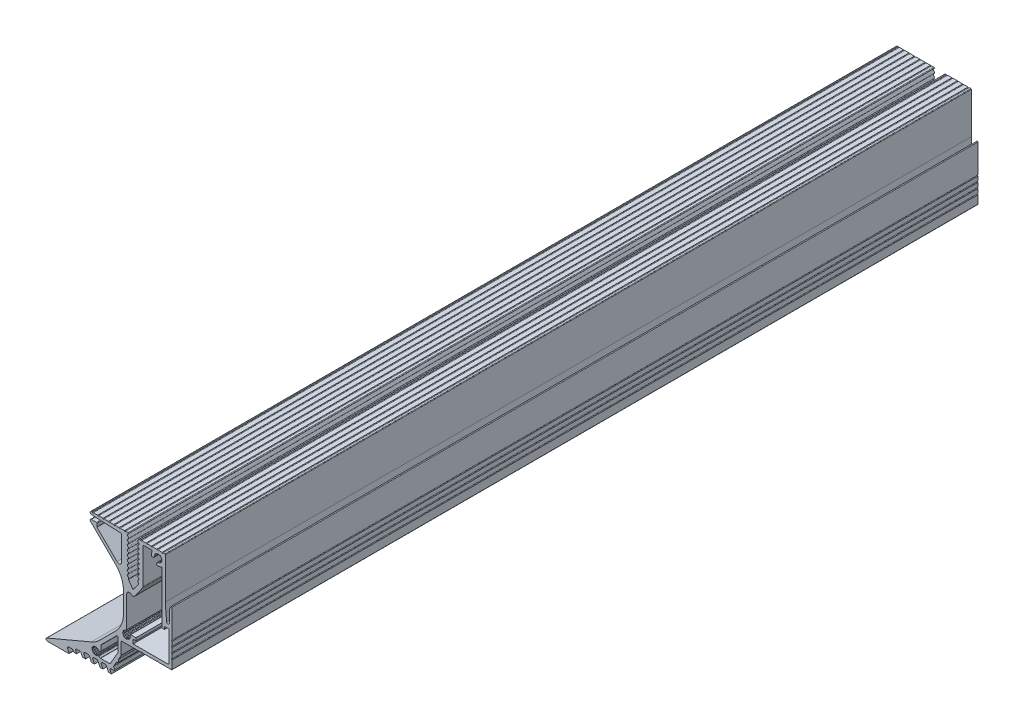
SolidWorks part; units mm, degrees
ref_plane "Спереди" through (0, 0, 0) normal (0, 0, 1) x (1, 0, 0)
ref_plane "Сверху" through (0, 0, 0) normal (0, 1, 0) x (1, 0, 0)
ref_plane "Справа" through (0, 0, 0) normal (1, 0, 0) x (0, 0, -1)
sketch "Model" plane through (0, 0, 0) normal (0, 0, 1) x (1, 0, 0)
  line L0 (487.9568, 2179.62) -> (493.7584, 2185.4217)
  line L1 (494.2706, 2185.2095) -> (494.2706, 2180.4042)
  line L2 (494.2036, 2180.1542) -> (491.4535, 2175.3909)
  line L3 (491.0205, 2175.1409) -> (487.7845, 2175.1409)
  line L4 (487.656, 2175.1877) -> (487.2191, 2175.5542)
  line L5 (487.4874, 2177.195) -> (487.742, 2177.2951)
  line L6 (487.8689, 2177.4813) -> (487.8689, 2179.4079)
  line L7 (503.8017, 2219.5596) -> (506.8266, 2219.5596)
  line L8 (507.0211, 2217.4924) -> (507.6614, 2217.6746)
  line L9 (508.8286, 2216.5431) -> (508.6662, 2215.8975)
  line L10 (510.6649, 2215.7229) -> (510.6649, 2196.5419)
  line L11 (510.8649, 2196.3419) -> (511.4649, 2196.3419)
  line L12 (511.6649, 2196.5419) -> (511.6649, 2197.3419)
  line L13 (511.6649, 2197.3419) -> (513.1649, 2197.3419)
  line L14 (513.1649, 2197.3419) -> (513.1649, 2186.0405)
  line L15 (512.9649, 2185.8405) -> (499.911, 2185.8405)
  line L16 (499.911, 2185.8405) -> (499.911, 2187.3405)
  line L17 (499.911, 2187.3405) -> (500.911, 2187.3405)
  line L18 (500.911, 2187.3405) -> (500.911, 2188.3405)
  line L19 (500.911, 2188.3405) -> (498.9519, 2188.3405)
  line L20 (497.4978, 2189.2112) -> (497.5049, 2200.7622)
  line L21 (500.644, 2201.6975) -> (503.4236, 2205.7071)
  line L22 (503.6017, 2206.2768) -> (503.6017, 2219.3596)
  line L23 (497.1063, 2220.7596) -> (497.9094, 2220.7596)
  line L24 (498.1801, 2205.7431) -> (499.7374, 2203.4967)
  line L25 (500.0661, 2203.4967) -> (501.961, 2206.2302)
  line L26 (502.2749, 2220.7596) -> (502.6808, 2220.7596)
  line L27 (503.0808, 2220.7596) -> (504.6808, 2220.7596)
  line L28 (505.0808, 2220.7596) -> (506.6808, 2220.7596)
  line L29 (507.0808, 2220.7596) -> (508.6808, 2220.7596)
  line L30 (509.0808, 2220.7596) -> (510.6849, 2220.7596)
  line L31 (511.0849, 2220.7596) -> (511.6649, 2220.7596)
  line L32 (511.8649, 2220.5596) -> (511.8649, 2205.3267)
  line L33 (511.8649, 2205.3267) -> (511.8656, 2205.3107)
  line L34 (511.8656, 2205.3107) -> (512.3527, 2199.2203)
  line L35 (513.3649, 2199.2608) -> (513.3649, 2203.5476)
  line L36 (513.3825, 2203.6296) -> (513.9825, 2204.9639)
  line L37 (514.3649, 2204.8818) -> (514.3649, 2194.2918)
  line L38 (514.3649, 2193.8918) -> (514.3649, 2192.2918)
  line L39 (514.3649, 2191.8918) -> (514.3649, 2190.2918)
  line L40 (514.3649, 2189.8918) -> (514.3649, 2188.2918)
  line L41 (514.3649, 2187.8918) -> (514.3649, 2184.8405)
  line L42 (514.1649, 2184.6405) -> (511.2386, 2184.6405)
  line L43 (510.8386, 2184.6405) -> (509.2386, 2184.6405)
  line L44 (508.8386, 2184.6405) -> (507.2386, 2184.6405)
  line L45 (506.8386, 2184.6405) -> (505.2386, 2184.6405)
  line L46 (504.8386, 2184.6405) -> (503.2386, 2184.6405)
  line L47 (502.8386, 2184.6405) -> (495.6706, 2184.6405)
  line L48 (495.4706, 2184.4405) -> (495.4706, 2180.0022)
  line L49 (495.4438, 2179.9022) -> (494.4435, 2178.1697)
  line L50 (493.5964, 2176.7025) -> (492.7401, 2175.2193)
  line L51 (492.72, 2174.758) -> (492.9505, 2174.2635)
  line L52 (491.3832, 2173.0905) -> (491.8262, 2172.1405)
  line L53 (491.8262, 2172.1405) -> (490.7229, 2172.1405)
  line L54 (490.7229, 2172.1405) -> (489.9247, 2173.8522)
  line L55 (489.4716, 2174.1409) -> (488.5093, 2174.1409)
  line L56 (488.0562, 2173.4296) -> (488.6572, 2172.1405)
  line L57 (488.6572, 2172.1405) -> (487.5539, 2172.1405)
  line L58 (487.5539, 2172.1405) -> (486.7557, 2173.8522)
  line L59 (486.3026, 2174.1409) -> (485.3403, 2174.1409)
  line L60 (484.8872, 2173.4296) -> (485.4882, 2172.1405)
  line L61 (485.4882, 2172.1405) -> (484.3849, 2172.1405)
  line L62 (484.3849, 2172.1405) -> (483.5867, 2173.8522)
  line L63 (483.1336, 2174.1409) -> (482.0302, 2174.1409)
  line L64 (481.577, 2173.4296) -> (482.1781, 2172.1405)
  line L65 (482.1781, 2172.1405) -> (481.0747, 2172.1405)
  line L66 (481.0747, 2172.1405) -> (480.5045, 2173.3634)
  line L67 (480.0514, 2173.652) -> (478.948, 2173.652)
  line L68 (478.4948, 2172.9407) -> (478.868, 2172.1405)
  line L69 (478.868, 2172.1405) -> (477.7646, 2172.1405)
  line L70 (477.7646, 2172.1405) -> (477.5468, 2172.6076)
  line L71 (477.0936, 2172.8963) -> (475.9903, 2172.8963)
  line L72 (475.5371, 2172.185) -> (476.0712, 2171.0397)
  line L73 (475.8899, 2170.7551) -> (467.9611, 2170.7551)
  line L74 (467.7697, 2171.6973) -> (484.3175, 2178.7105)
  line L75 (487.4864, 2180.8467) -> (493.376, 2186.7363)
  line L76 (496.3049, 2193.8074) -> (496.3049, 2201.1501)
  line L77 (493.3219, 2208.2748) -> (484.0554, 2217.4012)
  line L78 (484.4272, 2218.257) -> (486.2147, 2218.1819)
  line L79 (486.4063, 2217.9821) -> (486.4063, 2216.8539)
  line L80 (486.4659, 2216.7114) -> (493.9032, 2209.3866)
  line L81 (495.6049, 2210.099) -> (495.6049, 2219.0972)
  line L82 (495.4133, 2219.297) -> (484.3853, 2219.7601)
  line L83 (484.4063, 2220.7596) -> (484.7063, 2220.7596)
  line L84 (485.1063, 2220.7596) -> (486.7063, 2220.7596)
  line L85 (487.1063, 2220.7596) -> (488.7063, 2220.7596)
  line L86 (489.1063, 2220.7596) -> (490.7063, 2220.7596)
  line L87 (491.1063, 2220.7596) -> (492.7063, 2220.7596)
  line L88 (493.1063, 2220.7596) -> (494.7063, 2220.7596)
  line L89 (495.1063, 2220.7596) -> (496.7063, 2220.7596)
  arc A0 (496.1782, 2188.3188) -> (496.2333, 2188.3905) centre (488.2759, 2194.4469) ccw
  arc A1 (487.9568, 2179.62) -> (487.8689, 2179.4079) centre (488.1689, 2179.4079) ccw
  arc A2 (494.2706, 2185.2095) -> (493.7584, 2185.4217) centre (493.9706, 2185.2095) ccw
  arc A3 (494.2036, 2180.1542) -> (494.2706, 2180.4042) centre (493.7706, 2180.4042) ccw
  arc A4 (491.0205, 2175.1409) -> (491.4535, 2175.3909) centre (491.0205, 2175.6409) ccw
  arc A5 (487.656, 2175.1877) -> (487.7845, 2175.1409) centre (487.7845, 2175.3409) ccw
  arc A6 (487.2191, 2175.5542) -> (486.9455, 2175.5387) centre (487.0905, 2175.401) ccw
  arc A7 (486.7653, 2175.51) -> (486.9455, 2175.5387) centre (486.8366, 2175.6421) ccw
  arc A8 (486.7653, 2175.51) -> (486.4853, 2175.3536) centre (486.675, 2175.3428) ccw
  arc A9 (486.2139, 2175.2741) -> (486.4853, 2175.3536) centre (486.3354, 2175.3621) ccw
  arc A10 (486.2139, 2175.2741) -> (485.8937, 2175.2547) centre (486.06, 2175.1626) ccw
  arc A11 (485.6147, 2175.3008) -> (485.8937, 2175.2547) centre (485.7624, 2175.3274) ccw
  arc A12 (485.6147, 2175.3008) -> (485.3179, 2175.4222) centre (485.4277, 2175.2672) ccw
  arc A13 (485.0864, 2175.5849) -> (485.3179, 2175.4222) centre (485.231, 2175.5446) ccw
  arc A14 (485.0864, 2175.5849) -> (484.8717, 2175.823) centre (484.9034, 2175.6357) ccw
  arc A15 (484.7338, 2176.07) -> (484.8717, 2175.823) centre (484.8466, 2175.971) ccw
  arc A16 (484.7338, 2176.07) -> (484.6436, 2176.3777) centre (484.5909, 2176.1952) ccw
  arc A17 (484.6265, 2176.66) -> (484.6436, 2176.3777) centre (484.6853, 2176.5219) ccw
  arc A18 (484.6265, 2176.66) -> (484.6788, 2176.9764) centre (484.5521, 2176.8349) ccw
  arc A19 (484.7858, 2177.2382) -> (484.6788, 2176.9764) centre (484.7789, 2177.0883) ccw
  arc A20 (484.7858, 2177.2382) -> (484.9703, 2177.5006) centre (484.7947, 2177.428) ccw
  arc A21 (485.1803, 2177.69) -> (484.9703, 2177.5006) centre (485.109, 2177.558) ccw
  arc A22 (485.1803, 2177.69) -> (485.4603, 2177.8464) centre (485.2706, 2177.8572) ccw
  arc A23 (485.7323, 2177.9251) -> (485.4603, 2177.8464) centre (485.6101, 2177.8379) ccw
  arc A24 (485.7323, 2177.9251) -> (486.0518, 2177.9453) centre (485.8856, 2178.0374) ccw
  arc A25 (486.3309, 2177.8992) -> (486.0518, 2177.9453) centre (486.1832, 2177.8726) ccw
  arc A26 (486.3309, 2177.8992) -> (486.6277, 2177.7778) centre (486.5179, 2177.9329) ccw
  arc A27 (486.8591, 2177.6152) -> (486.6277, 2177.7778) centre (486.7145, 2177.6553) ccw
  arc A28 (486.8591, 2177.6152) -> (487.0739, 2177.377) centre (487.0422, 2177.5644) ccw
  arc A29 (487.2341, 2177.2943) -> (487.0739, 2177.377) centre (487.0989, 2177.229) ccw
  arc A30 (487.2341, 2177.2943) -> (487.4874, 2177.195) centre (487.4142, 2177.3812) ccw
  arc A31 (487.742, 2177.2951) -> (487.8689, 2177.4813) centre (487.6689, 2177.4813) ccw
  arc A32 (507.0042, 2219.2678) -> (506.8266, 2219.5596) centre (506.8266, 2219.3596) ccw
  arc A33 (507.0042, 2219.2678) -> (506.77, 2217.647) centre (509.225, 2218.1196) ccw
  arc A34 (506.77, 2217.647) -> (507.0211, 2217.4924) centre (506.9664, 2217.6848) ccw
  arc A35 (507.6614, 2217.6746) -> (507.8003, 2217.9174) centre (507.6069, 2217.8669) ccw
  arc A36 (507.8777, 2218.089) -> (507.8003, 2217.9174) centre (507.9455, 2217.9551) ccw
  arc A37 (507.8777, 2218.089) -> (507.9086, 2218.4082) centre (507.7917, 2218.2584) ccw
  arc A38 (507.9978, 2218.6766) -> (507.9086, 2218.4082) centre (508.001, 2218.5265) ccw
  arc A39 (507.9978, 2218.6766) -> (508.1642, 2218.9508) centre (507.9939, 2218.8666) ccw
  arc A40 (508.3611, 2219.1539) -> (508.1642, 2218.9508) centre (508.2988, 2219.0173) ccw
  arc A41 (508.3611, 2219.1539) -> (508.6299, 2219.3287) centre (508.4399, 2219.3267) ccw
  arc A42 (508.8954, 2219.4263) -> (508.6299, 2219.3287) centre (508.78, 2219.3303) ccw
  arc A43 (508.8954, 2219.4263) -> (509.2135, 2219.4671) centre (509.0414, 2219.5478) ccw
  arc A44 (509.495, 2219.4399) -> (509.2135, 2219.4671) centre (509.3494, 2219.4034) ccw
  arc A45 (509.495, 2219.4399) -> (509.7993, 2219.3387) centre (509.6793, 2219.486) ccw
  arc A46 (510.0411, 2219.1919) -> (509.7993, 2219.3387) centre (509.8941, 2219.2223) ccw
  arc A47 (510.0411, 2219.1919) -> (510.2714, 2218.9687) centre (510.2272, 2219.1535) ccw
  arc A48 (510.4256, 2218.7316) -> (510.2714, 2218.9687) centre (510.3063, 2218.8227) ccw
  arc A49 (510.4256, 2218.7316) -> (510.5362, 2218.4306) centre (510.5766, 2218.6163) ccw
  arc A50 (510.5723, 2218.1501) -> (510.5362, 2218.4306) centre (510.5043, 2218.2839) ccw
  arc A51 (510.5723, 2218.1501) -> (510.5413, 2217.8309) centre (510.6582, 2217.9806) ccw
  arc A52 (510.4521, 2217.5625) -> (510.5413, 2217.8309) centre (510.449, 2217.7125) ccw
  arc A53 (510.4521, 2217.5625) -> (510.2857, 2217.2883) centre (510.456, 2217.3725) ccw
  arc A54 (510.0889, 2217.0852) -> (510.2857, 2217.2883) centre (510.1512, 2217.2218) ccw
  arc A55 (510.0889, 2217.0852) -> (509.82, 2216.9104) centre (510.01, 2216.9123) ccw
  arc A56 (509.5545, 2216.8128) -> (509.82, 2216.9104) centre (509.6699, 2216.9087) ccw
  arc A57 (509.5545, 2216.8128) -> (509.2364, 2216.7719) centre (509.4085, 2216.6913) ccw
  arc A58 (509.0671, 2216.6893) -> (509.2364, 2216.7719) centre (509.1005, 2216.8356) ccw
  arc A59 (509.0671, 2216.6893) -> (508.8286, 2216.5431) centre (509.0225, 2216.4944) ccw
  arc A60 (508.6662, 2215.8975) -> (508.8284, 2215.6512) centre (508.8591, 2215.848) ccw
  arc A61 (508.8284, 2215.6512) -> (510.3726, 2215.9003) centre (509.2249, 2218.1045) ccw
  arc A62 (510.6649, 2215.7229) -> (510.3726, 2215.9003) centre (510.4649, 2215.7229) ccw
  arc A63 (510.6649, 2196.5419) -> (510.8649, 2196.3419) centre (510.8649, 2196.5419) ccw
  arc A64 (511.4649, 2196.3419) -> (511.6649, 2196.5419) centre (511.4649, 2196.5419) ccw
  arc A65 (512.9649, 2185.8405) -> (513.1649, 2186.0405) centre (512.9649, 2186.0405) ccw
  arc A66 (498.9519, 2188.3405) -> (498.7673, 2188.0635) centre (498.9519, 2188.1405) ccw
  arc A67 (498.7229, 2187.8889) -> (498.7673, 2188.0635) centre (498.6288, 2188.0058) ccw
  arc A68 (498.7229, 2187.8889) -> (498.7586, 2187.5702) centre (498.8421, 2187.7409) ccw
  arc A69 (498.7268, 2187.2891) -> (498.7586, 2187.5702) centre (498.6928, 2187.4353) ccw
  arc A70 (498.7268, 2187.2891) -> (498.6207, 2186.9865) centre (498.7699, 2187.1041) ccw
  arc A71 (498.4701, 2186.7471) -> (498.6207, 2186.9865) centre (498.5028, 2186.8936) ccw
  arc A72 (498.4701, 2186.7471) -> (498.2432, 2186.5205) centre (498.4286, 2186.5617) ccw
  arc A73 (498.0036, 2186.3701) -> (498.2432, 2186.5205) centre (498.0966, 2186.4879) ccw
  arc A74 (498.0036, 2186.3701) -> (497.7008, 2186.2644) centre (497.8858, 2186.221) ccw
  arc A75 (497.4197, 2186.2329) -> (497.7008, 2186.2644) centre (497.5547, 2186.2986) ccw
  arc A76 (497.4197, 2186.2329) -> (497.1011, 2186.269) centre (497.2489, 2186.1497) ccw
  arc A77 (496.8342, 2186.3626) -> (497.1011, 2186.269) centre (496.9843, 2186.3632) ccw
  arc A78 (496.8342, 2186.3626) -> (496.5627, 2186.5333) centre (496.6442, 2186.3617) ccw
  arc A79 (496.3628, 2186.7335) -> (496.5627, 2186.5333) centre (496.4984, 2186.669) ccw
  arc A80 (496.3628, 2186.7335) -> (496.1924, 2187.0051) centre (496.1913, 2186.8151) ccw
  arc A81 (496.0991, 2187.2721) -> (496.1924, 2187.0051) centre (496.1933, 2187.1552) ccw
  arc A82 (496.0991, 2187.2721) -> (496.0634, 2187.5908) centre (495.98, 2187.4201) ccw
  arc A83 (496.0952, 2187.8719) -> (496.0634, 2187.5908) centre (496.1293, 2187.7257) ccw
  arc A84 (496.0952, 2187.8719) -> (496.2013, 2188.1745) centre (496.0521, 2188.0569) ccw
  arc A85 (496.352, 2188.4139) -> (496.2013, 2188.1745) centre (496.3192, 2188.2674) ccw
  arc A86 (496.352, 2188.4139) -> (496.5789, 2188.6405) centre (496.3934, 2188.5993) ccw
  arc A87 (496.8185, 2188.7909) -> (496.5789, 2188.6405) centre (496.7254, 2188.6731) ccw
  arc A88 (496.8185, 2188.7909) -> (497.1212, 2188.8966) centre (496.9362, 2188.94) ccw
  arc A89 (497.2804, 2189.012) -> (497.1212, 2188.8966) centre (497.2674, 2188.8625) ccw
  arc A90 (497.2804, 2189.012) -> (497.4978, 2189.2112) centre (497.2979, 2189.2111) ccw
  arc A91 (499.1635, 2201.5147) -> (497.5049, 2200.7622) centre (498.5049, 2200.7622) ccw
  arc A92 (499.1635, 2201.5147) -> (500.644, 2201.6975) centre (499.8222, 2202.2672) ccw
  arc A93 (503.4236, 2205.7071) -> (503.6017, 2206.2768) centre (502.6017, 2206.2768) ccw
  arc A94 (503.8017, 2219.5596) -> (503.6017, 2219.3596) centre (503.8017, 2219.3596) ccw
  arc A95 (498.0336, 2220.4028) -> (497.9094, 2220.7596) centre (497.9122, 2220.5606) ccw
  arc A96 (497.9562, 2220.3533) -> (498.0336, 2220.4028) centre (497.7511, 2220.7596) ccw
  arc A97 (497.9562, 2220.3533) -> (497.9562, 2219.5408) centre (498.161, 2219.9471) ccw
  arc A98 (497.9562, 2218.7283) -> (497.9562, 2219.5408) centre (497.7593, 2219.1346) ccw
  arc A99 (497.9562, 2218.7283) -> (497.9562, 2217.9158) centre (498.1613, 2218.3221) ccw
  arc A100 (497.9562, 2217.1033) -> (497.9562, 2217.9158) centre (497.7512, 2217.5096) ccw
  arc A101 (497.9562, 2217.1033) -> (497.9562, 2216.2908) centre (498.1613, 2216.6971) ccw
  arc A102 (497.9562, 2215.4783) -> (497.9562, 2216.2908) centre (497.7511, 2215.8846) ccw
  arc A103 (497.9562, 2215.4783) -> (497.9562, 2214.6658) centre (498.1613, 2215.0721) ccw
  arc A104 (497.9562, 2213.8533) -> (497.9562, 2214.6658) centre (497.7511, 2214.2596) ccw
  arc A105 (497.9562, 2213.8533) -> (497.9562, 2213.0408) centre (498.1613, 2213.4471) ccw
  arc A106 (497.9562, 2212.2283) -> (497.9562, 2213.0408) centre (497.7511, 2212.6346) ccw
  arc A107 (497.9562, 2212.2283) -> (497.9562, 2211.4158) centre (498.1613, 2211.8221) ccw
  arc A108 (497.9562, 2210.6033) -> (497.9562, 2211.4158) centre (497.7511, 2211.0096) ccw
  arc A109 (497.9562, 2210.6033) -> (497.9562, 2209.7908) centre (498.1613, 2210.1971) ccw
  arc A110 (497.9562, 2208.9783) -> (497.9562, 2209.7908) centre (497.7513, 2209.3846) ccw
  arc A111 (497.9562, 2208.9783) -> (497.9562, 2208.1658) centre (498.1613, 2208.5721) ccw
  arc A112 (497.9562, 2207.3533) -> (497.9562, 2208.1658) centre (497.7511, 2207.7596) ccw
  arc A113 (497.9562, 2207.3533) -> (497.9562, 2206.5408) centre (498.1613, 2206.9471) ccw
  arc A114 (498.1633, 2205.9418) -> (497.9562, 2206.5408) centre (497.7512, 2206.1346) ccw
  arc A115 (498.1633, 2205.9418) -> (498.1801, 2205.7431) centre (498.3445, 2205.857) ccw
  arc A116 (499.7374, 2203.4967) -> (500.0661, 2203.4967) centre (499.9017, 2203.6107) ccw
  arc A117 (501.961, 2206.2302) -> (501.9107, 2206.5084) centre (501.7967, 2206.3441) ccw
  arc A118 (501.9107, 2206.5084) -> (501.8562, 2206.5408) centre (501.6511, 2206.1346) ccw
  arc A119 (501.8562, 2207.3533) -> (501.8562, 2206.5408) centre (502.0612, 2206.9471) ccw
  arc A120 (501.8562, 2207.3533) -> (501.8562, 2208.1658) centre (501.6511, 2207.7596) ccw
  arc A121 (501.8562, 2208.9783) -> (501.8562, 2208.1658) centre (502.0612, 2208.5721) ccw
  arc A122 (501.8562, 2208.9783) -> (501.8562, 2209.7908) centre (501.6511, 2209.3846) ccw
  arc A123 (501.8562, 2210.6033) -> (501.8562, 2209.7908) centre (502.0612, 2210.1971) ccw
  arc A124 (501.8562, 2210.6033) -> (501.8562, 2211.4158) centre (501.6511, 2211.0096) ccw
  arc A125 (501.8562, 2212.2283) -> (501.8562, 2211.4158) centre (502.0612, 2211.8221) ccw
  arc A126 (501.8562, 2212.2283) -> (501.8562, 2213.0408) centre (501.6511, 2212.6346) ccw
  arc A127 (501.8562, 2213.8533) -> (501.8562, 2213.0408) centre (502.0612, 2213.4471) ccw
  arc A128 (501.8562, 2213.8533) -> (501.8562, 2214.6658) centre (501.6511, 2214.2596) ccw
  arc A129 (501.8562, 2215.4783) -> (501.8562, 2214.6658) centre (502.0613, 2215.0721) ccw
  arc A130 (501.8562, 2215.4783) -> (501.8562, 2216.2908) centre (501.6511, 2215.8846) ccw
  arc A131 (501.8562, 2217.1033) -> (501.8562, 2216.2908) centre (502.0613, 2216.6971) ccw
  arc A132 (501.8562, 2217.1033) -> (501.8562, 2217.9158) centre (501.6511, 2217.5096) ccw
  arc A133 (501.8562, 2218.7283) -> (501.8562, 2217.9158) centre (502.0612, 2218.3221) ccw
  arc A134 (501.8562, 2218.7283) -> (501.8562, 2219.5408) centre (501.6511, 2219.1346) ccw
  arc A135 (501.8562, 2220.3533) -> (501.8562, 2219.5408) centre (502.0596, 2219.9471) ccw
  arc A136 (501.8562, 2220.3533) -> (502.0845, 2220.6207) centre (501.6511, 2220.7596) ccw
  arc A137 (502.2749, 2220.7596) -> (502.0845, 2220.6207) centre (502.2746, 2220.56) ccw
  arc A138 (502.6808, 2220.7596) -> (503.0808, 2220.7596) centre (502.8808, 2220.7596) ccw
  arc A139 (504.6808, 2220.7596) -> (505.0808, 2220.7596) centre (504.8808, 2220.7596) ccw
  arc A140 (506.6808, 2220.7596) -> (507.0808, 2220.7596) centre (506.8808, 2220.7596) ccw
  arc A141 (508.6808, 2220.7596) -> (509.0808, 2220.7596) centre (508.8808, 2220.7596) ccw
  arc A142 (510.6849, 2220.7596) -> (511.0849, 2220.7596) centre (510.8849, 2220.7596) ccw
  arc A143 (511.8649, 2220.5596) -> (511.6649, 2220.7596) centre (511.6649, 2220.5596) ccw
  arc A144 (512.3527, 2199.2203) -> (513.3649, 2199.2608) centre (512.858, 2199.2608) ccw
  arc A145 (513.3825, 2203.6296) -> (513.3649, 2203.5476) centre (513.5649, 2203.5476) ccw
  arc A146 (514.3649, 2204.8818) -> (513.9825, 2204.9639) centre (514.1649, 2204.8818) ccw
  arc A147 (514.3649, 2194.2918) -> (514.3649, 2193.8918) centre (514.3649, 2194.0918) ccw
  arc A148 (514.3649, 2192.2918) -> (514.3649, 2191.8918) centre (514.3649, 2192.0918) ccw
  arc A149 (514.3649, 2190.2918) -> (514.3649, 2189.8918) centre (514.3649, 2190.0918) ccw
  arc A150 (514.3649, 2188.2918) -> (514.3649, 2187.8918) centre (514.3649, 2188.0918) ccw
  arc A151 (514.1649, 2184.6405) -> (514.3649, 2184.8405) centre (514.1649, 2184.8405) ccw
  arc A152 (511.2386, 2184.6405) -> (510.8386, 2184.6405) centre (511.0386, 2184.6405) ccw
  arc A153 (509.2386, 2184.6405) -> (508.8386, 2184.6405) centre (509.0386, 2184.6405) ccw
  arc A154 (507.2386, 2184.6405) -> (506.8386, 2184.6405) centre (507.0386, 2184.6405) ccw
  arc A155 (505.2386, 2184.6405) -> (504.8386, 2184.6405) centre (505.0386, 2184.6405) ccw
  arc A156 (503.2386, 2184.6405) -> (502.8386, 2184.6405) centre (503.0386, 2184.6405) ccw
  arc A157 (495.6706, 2184.6405) -> (495.4706, 2184.4405) centre (495.6706, 2184.4405) ccw
  arc A158 (495.4438, 2179.9022) -> (495.4706, 2180.0022) centre (495.2706, 2180.0022) ccw
  arc A159 (494.4435, 2178.1697) -> (494.4346, 2177.6858) centre (494.8765, 2177.9197) ccw
  arc A160 (494.0111, 2176.9521) -> (494.4346, 2177.6858) centre (493.9928, 2177.4518) ccw
  arc A161 (494.0111, 2176.9521) -> (493.5964, 2176.7025) centre (494.0294, 2176.4525) ccw
  arc A162 (492.7401, 2175.2193) -> (492.72, 2174.758) centre (493.1731, 2174.9693) ccw
  arc A163 (492.1669, 2173.677) -> (492.9505, 2174.2635) centre (492.4974, 2174.0522) ccw
  arc A164 (492.1669, 2173.677) -> (491.3832, 2173.0905) centre (491.8364, 2173.3018) ccw
  arc A165 (489.9247, 2173.8522) -> (489.4716, 2174.1409) centre (489.4716, 2173.6409) ccw
  arc A166 (488.5093, 2174.1409) -> (488.0562, 2173.4296) centre (488.5093, 2173.6409) ccw
  arc A167 (486.7557, 2173.8522) -> (486.3026, 2174.1409) centre (486.3026, 2173.6409) ccw
  arc A168 (485.3403, 2174.1409) -> (484.8872, 2173.4296) centre (485.3403, 2173.6409) ccw
  arc A169 (483.5867, 2173.8522) -> (483.1336, 2174.1409) centre (483.1336, 2173.6409) ccw
  arc A170 (482.0302, 2174.1409) -> (481.577, 2173.4296) centre (482.0302, 2173.6409) ccw
  arc A171 (480.5045, 2173.3634) -> (480.0514, 2173.652) centre (480.0514, 2173.152) ccw
  arc A172 (478.948, 2173.652) -> (478.4948, 2172.9407) centre (478.948, 2173.152) ccw
  arc A173 (477.5468, 2172.6076) -> (477.0936, 2172.8963) centre (477.0936, 2172.3963) ccw
  arc A174 (475.9903, 2172.8963) -> (475.5371, 2172.185) centre (475.9903, 2172.3963) ccw
  arc A175 (475.8899, 2170.7551) -> (476.0712, 2171.0397) centre (475.8899, 2170.9551) ccw
  arc A176 (467.7697, 2171.6973) -> (467.9611, 2170.7551) centre (467.9611, 2171.2457) ccw
  arc A177 (484.3175, 2178.7105) -> (487.4864, 2180.8467) centre (480.4153, 2187.9177) ccw
  arc A178 (493.376, 2186.7363) -> (496.3049, 2193.8074) centre (486.3049, 2193.8074) ccw
  arc A179 (496.3049, 2201.1501) -> (493.3219, 2208.2748) centre (486.3049, 2201.1501) ccw
  arc A180 (484.4272, 2218.257) -> (484.0554, 2217.4012) centre (484.4063, 2217.7574) ccw
  arc A181 (486.4063, 2217.9821) -> (486.2147, 2218.1819) centre (486.2063, 2217.9821) ccw
  arc A182 (486.4063, 2216.8539) -> (486.4659, 2216.7114) centre (486.6063, 2216.8539) ccw
  arc A183 (493.9032, 2209.3866) -> (495.6049, 2210.099) centre (494.6049, 2210.099) ccw
  arc A184 (495.6049, 2219.0972) -> (495.4133, 2219.297) centre (495.4049, 2219.0972) ccw
  arc A185 (484.4063, 2220.7596) -> (484.3853, 2219.7601) centre (484.4063, 2220.2596) ccw
  arc A186 (484.7063, 2220.7596) -> (485.1063, 2220.7596) centre (484.9063, 2220.7596) ccw
  arc A187 (486.7063, 2220.7596) -> (487.1063, 2220.7596) centre (486.9063, 2220.7596) ccw
  arc A188 (488.7063, 2220.7596) -> (489.1063, 2220.7596) centre (488.9063, 2220.7596) ccw
  arc A189 (490.7063, 2220.7596) -> (491.1063, 2220.7596) centre (490.9063, 2220.7596) ccw
  arc A190 (492.7063, 2220.7596) -> (493.1063, 2220.7596) centre (492.9063, 2220.7596) ccw
  arc A191 (494.7063, 2220.7596) -> (495.1063, 2220.7596) centre (494.9063, 2220.7596) ccw
  arc A192 (496.7063, 2220.7596) -> (497.1063, 2220.7596) centre (496.9063, 2220.7596) ccw
extrude "Бобышка-Вытянуть1" add sketch "Model" along normal blind 300 contours A192 L89 A191 L88 A190 L87 A189 L86 A188 L85 A187 L84 A186 L83 A185 L82 A184 L81 A183 L80 A182 L79 A181 L78 A180 L77 A179 L76 A178 L75 A177 L74 A176 L73 A175 L72 A174 L71 A173 L70 L69 L68 A172 L67 A171 L66 L65 L64 A170 L63 A169
